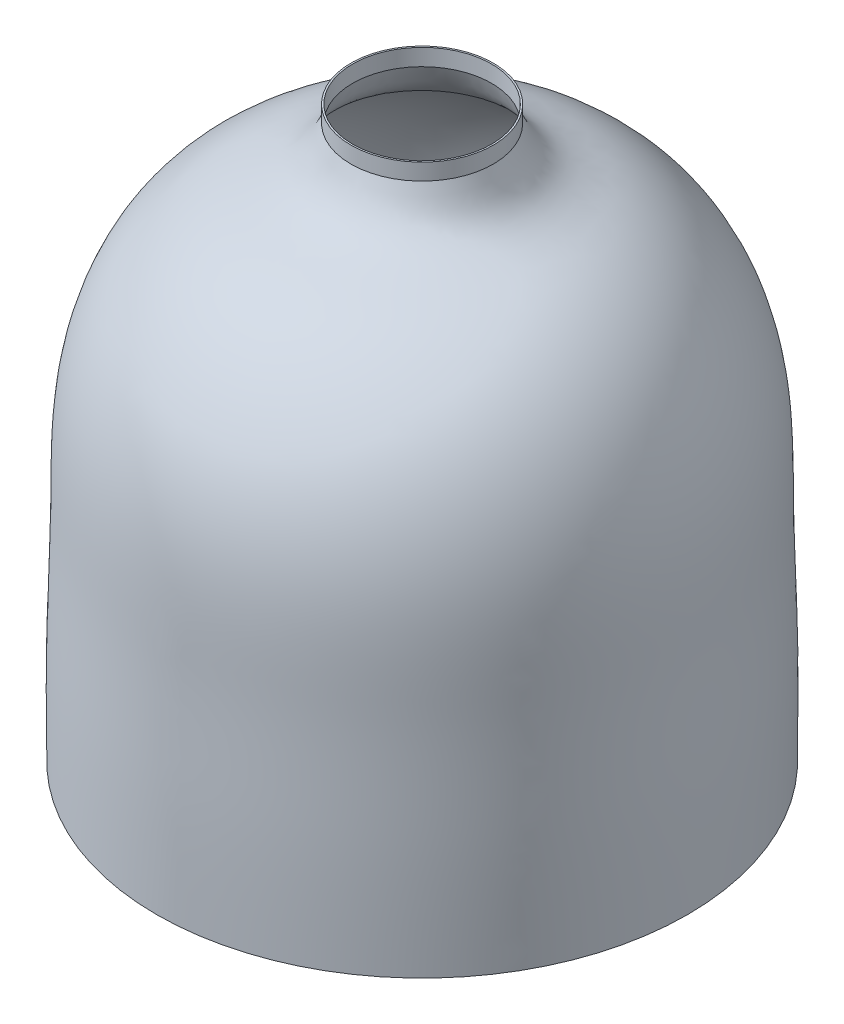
SolidWorks part; units mm, degrees
ref_plane "Face" through (0, 0, 0) normal (0, 0, 1) x (1, 0, 0)
ref_plane "Dessus" through (0, 0, 0) normal (0, 1, 0) x (1, 0, 0)
ref_plane "Droite" through (0, 0, 0) normal (1, 0, 0) x (0, 0, -1)
sketch "Esquisse1" plane through (0, 0, 0) normal (0, 0, 1) x (1, 0, 0)
  line L0 (0, 0) -> (0, -104) construction
  line L2 (13, 0) -> (13, -3)
  spline_without_curve S0
revolve "Révol.-Mince1" add sketch "Esquisse1" angle 360 about L0
